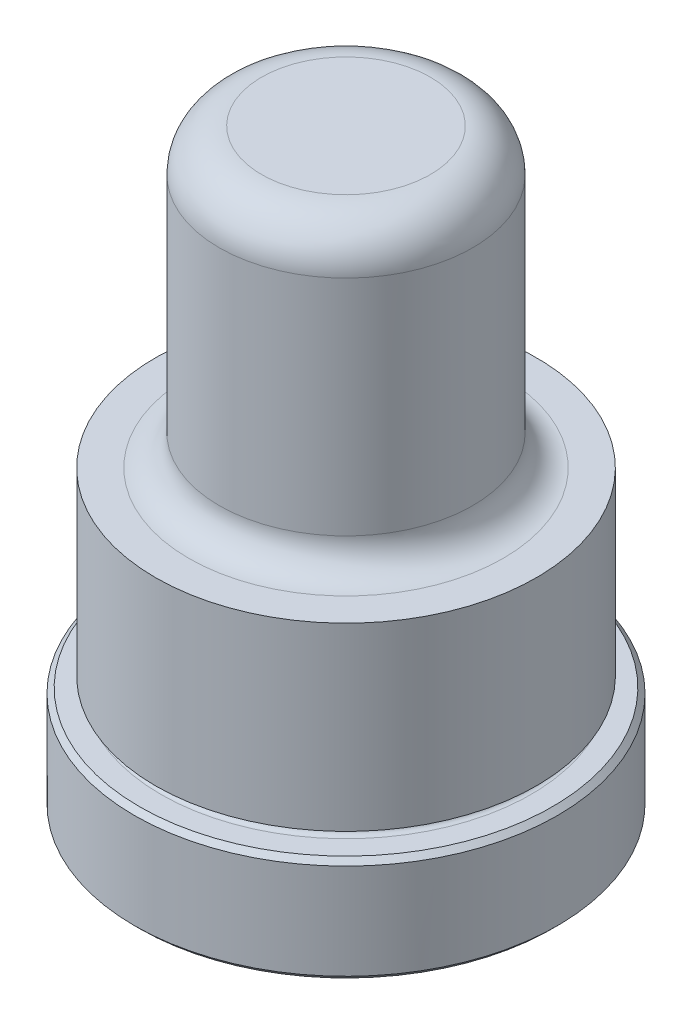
SolidWorks part; units mm, degrees
ref_plane "Front Plane" through (0, 0, 0) normal (0, 0, 1) x (1, 0, 0)
ref_plane "Top Plane" through (0, 0, 0) normal (0, 1, 0) x (1, 0, 0)
ref_plane "Right Plane" through (0, 0, 0) normal (1, 0, 0) x (0, 0, -1)
sketch "Sketch1" plane through (0, 0, 0) normal (1, 0, 0) x (0, 0, -1)
  line L0 (0, 0) -> (15.875, 0)
  line L1 (15.875, 0) -> (15.875, 7.9248)
  line L2 (15.875, 7.9248) -> (13.8938, 7.9248)
  line L3 (13.5128, 2.6782) -> (13.5128, 5.9795) construction
  line L4 (13.8938, 8.6868) -> (14.3002, 8.6868)
  line L5 (14.3002, 8.6868) -> (14.3002, 22.225)
  line L6 (14.3002, 22.225) -> (11.7983, 22.225)
  line L7 (9.5123, 24.511) -> (9.5123, 44.45)
  line L9 (9.5123, 44.45) -> (0, 44.45)
  line L10 (0, 44.45) -> (0, 0)
  line L11 (0, 0) -> (0, -7.2694) construction
  arc A0 (13.8938, 8.6868) -> (13.8938, 7.9248) centre (13.8938, 8.3058) ccw
  arc A1 (11.7983, 22.225) -> (9.5123, 24.511) centre (11.7983, 24.511) cw
  point P2 (9.5123, 44.45)
  point P14 (9.5123, 44.3364)
  point P19 (9.5123, 22.225)
  dimension "D14" = 0.762
  dimension "D8" = 2.286
  dimension "T" = 7.9248
  dimension "D2" = 0.762
  dimension "M" = 31.75
  dimension "B" = 28.6004
  dimension "L" = 44.45
  dimension "D7" = 0.7874
  dimension "A" = 22.225
  dimension "D" = 19.0246
  dimension "D15" = 22.225
revolve "Revolve1" add sketch "Sketch1" angle 360 about L11
chamfer "Chamfer1" distance 0.381 angle 45 2 edges at (0, 0, 15.875) (0, 7.9248, 15.875)
fillet "Fillet1" radius 3.175 1 edges at (0, 44.45, 9.5123)
